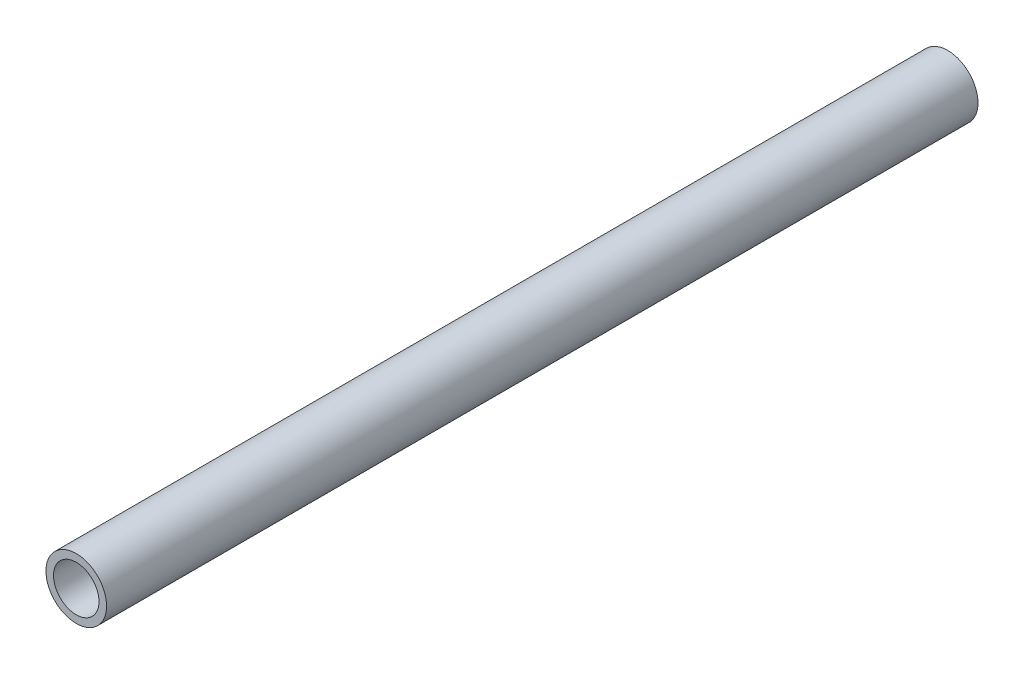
SolidWorks part; units mm, degrees
ref_plane "前视基准面" through (0, 0, 0) normal (0, 0, 1) x (1, 0, 0)
ref_plane "上视基准面" through (0, 0, 0) normal (0, 1, 0) x (1, 0, 0)
ref_plane "右视基准面" through (0, 0, 0) normal (1, 0, 0) x (0, 0, -1)
other "Configuration Table"
sketch "草图1" plane through (0, 0, 0) normal (0, 0, 1) x (1, 0, 0)
  circle A0 centre (0, 0) radius 4
  circle A1 centre (0, 0) radius 3
  dimension "D1" = 8
  dimension "D2" = 6
extrude "凸台-拉伸1" add sketch "草图1" along normal blind 115
